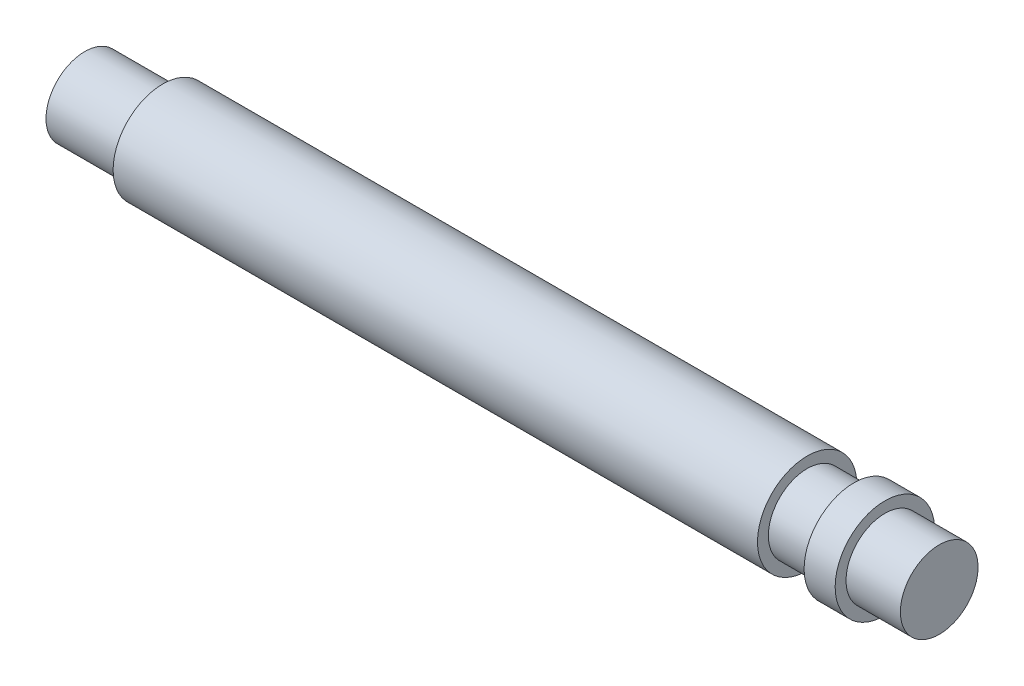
SolidWorks part; units mm, degrees
ref_plane "Front Plane" through (0, 0, 0) normal (0, 0, 1) x (1, 0, 0)
ref_plane "Top Plane" through (0, 0, 0) normal (0, 1, 0) x (1, 0, 0)
ref_plane "Right Plane" through (0, 0, 0) normal (1, 0, 0) x (0, 0, -1)
sketch "Sketch1" plane through (0, 0, 0) normal (0, 0, 1) x (1, 0, 0)
  line L0 (-703.4006, 0) -> (34466.6293, 0) construction
  line L1 (0, -703.4006) -> (0, 34466.6293) construction
  line L2 (0, 0) -> (0, 6.35)
  line L3 (0, 6.35) -> (-8.89, 6.35)
  line L4 (-8.89, 6.35) -> (-8.89, 8.128)
  line L5 (-8.89, 8.128) -> (-13.97, 8.128)
  line L6 (-13.97, 8.128) -> (-13.97, 6.35)
  line L7 (-13.97, 6.35) -> (-21.59, 6.35)
  line L8 (-21.59, 6.35) -> (-21.59, 8.128)
  line L9 (-21.59, 8.128) -> (-126.9503, 8.128)
  line L10 (-126.9503, 8.128) -> (-126.9503, 6.35)
  line L11 (-126.9503, 6.35) -> (-139.7, 6.35)
  line L12 (-139.7, 6.35) -> (-139.7, 0)
  line L13 (-139.7, 0) -> (0, 0)
  dimension "D1" = 139.7
  dimension "D2" = 12.7497
  dimension "D3" = 1.778
  dimension "D4" = 6.35
  dimension "D5" = 7.62
  dimension "D6" = 8.89
  dimension "D7" = 5.08
revolve "Revolve1" add sketch "Sketch1" angle 360 about L13
